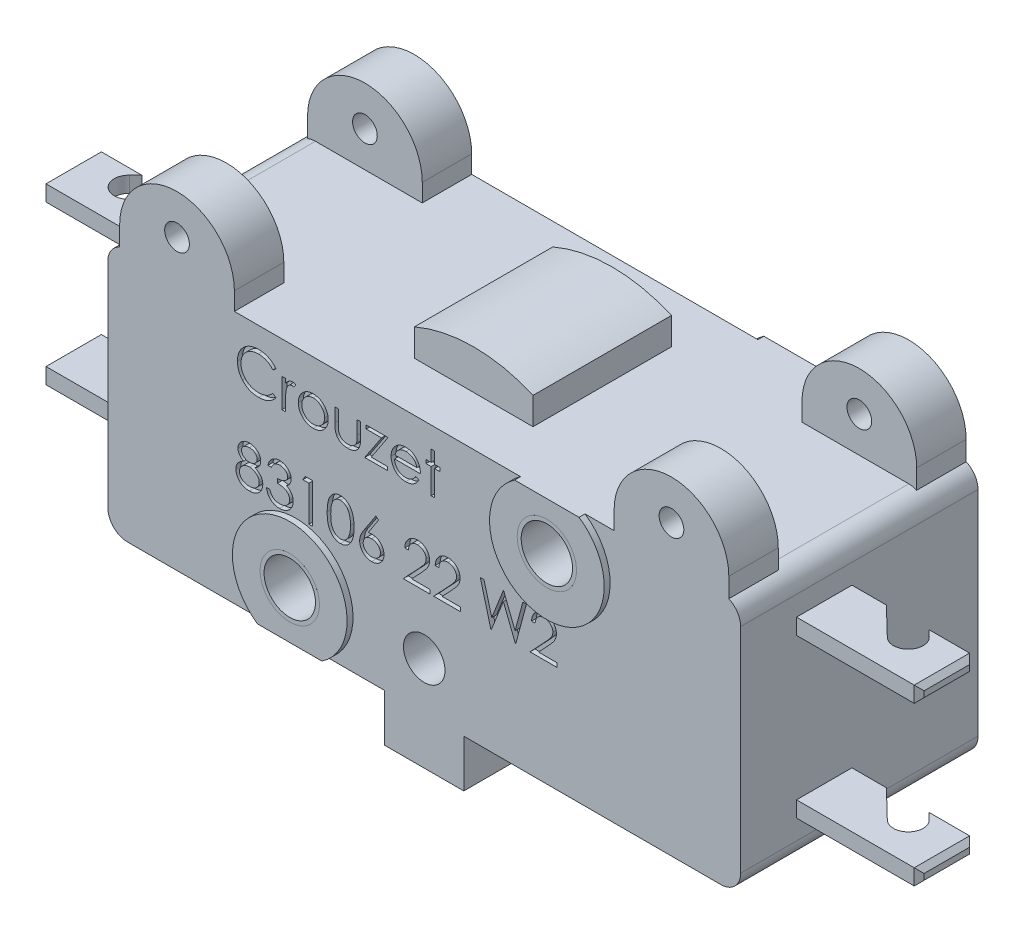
SolidWorks part; units mm, degrees
ref_plane "Plan de face" through (0, 0, 0) normal (0, 0, 1) x (1, 0, 0)
ref_plane "Plan de dessus" through (0, 0, 0) normal (0, 1, 0) x (1, 0, 0)
ref_plane "Plan de droite" through (0, 0, 0) normal (1, 0, 0) x (0, 0, -1)
sketch "Esquisse1" plane through (0, 0, 0) normal (0, 0, 1) x (1, 0, 0)
  line L0 (0, 0) -> (0, 25.0834) construction
  line L1 (-2, 0) -> (-16, 0)
  line L2 (-15.4, 13.7) -> (-15.4, 12.8)
  line L3 (-9.6, 12.8) -> (-9.6, 13.7)
  line L4 (16, 12.8) -> (16, 0)
  line L5 (-15.4, 12.8) -> (-16, 12.8)
  line L7 (-16, 12.8) -> (-16, 0)
  line L8 (12.5, 16.6) -> (18.6013, 16.6) construction
  line L9 (16, 12.8) -> (15.4, 12.8)
  line L10 (-9.6, 12.8) -> (9.6, 12.8)
  line L12 (9.6, 12.8) -> (9.6, 13.7)
  line L13 (15.4, 13.7) -> (15.4, 12.8)
  line L14 (-2, 0) -> (-2, -2.4)
  line L15 (-2, -2.4) -> (2, -2.4)
  line L16 (2, 0) -> (2, -2.4)
  line L17 (2, 0) -> (16, 0)
  line L18 (12.5, 14.6) -> (12.5, 13.7) construction
  arc A0 (15.4, 13.7) -> (9.6, 13.7) centre (12.5, 13.7) ccw
  arc A1 (-15.4, 13.7) -> (-9.6, 13.7) centre (-12.5, 13.7) cw
  circle A2 centre (12.5, 14.6) radius 0.625
  circle A3 centre (-12.5, 14.6) radius 0.625
  point P25 (0, 12.8)
  dimension "D7" = 25
  dimension "D5" = 1.25
  dimension "D8" = 2.9
  dimension "D1" = 32
  dimension "D2" = 12.8
  dimension "D3" = 4
  dimension "D4" = 16.6
  dimension "D6" = 2.4
  dimension "D9" = 1.8
  dimension "D10" = 12.8
extrude "Boss.-Extru.1" add sketch "Esquisse1" along normal mid plane 12
sketch "Esquisse2" plane through (0, 0, 0) normal (1, 0, 0) x (0, 0, -1)
  line L0 (-6, 12.8) -> (6, 12.8) construction
  line L1 (-3.5, 16.6) -> (3.5, 16.6)
  line L2 (-3.5, 16.6) -> (-3.5, 12.8)
  line L3 (-3.5, 12.8) -> (3.5, 12.8)
  line L4 (3.5, 16.6) -> (3.5, 12.8)
  line L5 (0, 0) -> (0, 16.6) construction
  line L6 (6, 16.6) -> (-6, 16.6) construction
  dimension "D1" = 7
extrude "Enlèv. mat.-Extru.1" cut sketch "Esquisse2" against normal mid plane 100
fillet "Congé1" radius 1 4 edges at (16, 12.8, 0) (-16, 12.8, 0) (-16, 0, 0) (16, 0, 0)
sketch "Esquisse3" plane through (0, 0, 6) normal (0, 0, 1) x (1, 0, 0)
  line L0 (0, 0) -> (0, 17.1631) construction
  line L1 (-15, 0) -> (-2, 0) construction
  circle A0 centre (-6.5, 2.4) radius 1.5
  circle A1 centre (6.5, 10.4) radius 1.5
  dimension "D5" = 3
  dimension "D1" = 13
  dimension "D2" = 8
  dimension "D3" = 13
  dimension "D4" = 2.4
extrude "Enlèv. mat.-Extru.2" cut sketch "Esquisse3" against normal through all
sketch "Esquisse4" plane through (0, 0, 6) normal (0, 0, 1) x (1, 0, 0)
  line L0 (0, 0) -> (0, 2.4) construction
  line L1 (-6.5, 2.4) -> (0, 2.4) construction
  circle A0 centre (0, 2.4) radius 1.05
  dimension "D1" = 2.1
extrude "Enlèv. mat.-Extru.3" cut sketch "Esquisse4" against normal blind 3
sketch "Esquisse6" plane through (0, 0, -6) normal (0, 0, -1) x (-1, 0, 0)
  line L2 (-9.6, 12.8) -> (9.6, 12.8) construction
  line L3 (15, 0) -> (2, 0) construction
  line L4 (-8.1279, 12.8) -> (-4.8721, 12.8)
  line L5 (8.1279, 0) -> (4.8721, 0)
  arc A0 (-8.1279, 12.8) -> (-4.8721, 12.8) centre (-6.5, 10.4) ccw
  arc A1 (8.1279, 0) -> (4.8721, 0) centre (6.5, 2.4) ccw
  circle A2 centre (-6.5, 10.4) radius 1.5 construction
  circle A3 centre (6.5, 2.4) radius 1.5 construction
  circle A4 centre (-6.5, 10.4) radius 1.5
  circle A5 centre (6.5, 2.4) radius 1.5
  dimension "D1" = 5.8
extrude "Boss.-Extru.3" add sketch "Esquisse6" along normal blind 0.3
sketch "Esquisse7" plane through (0, 0, 0) normal (0, 0, 1) x (1, 0, 0)
  line L0 (0, 0) -> (0, 14.8) construction
  line L1 (9.6, 12.8) -> (-9.6, 12.8) construction
  line L2 (-3, 12.8) -> (3, 12.8)
  line L3 (-3, 12.8) -> (-3, 14.1739)
  line L4 (-3, 14.1739) -> (3, 14.1739) construction
  line L5 (3, 12.8) -> (3, 14.1739)
  arc A0 (3, 14.1739) -> (-3, 14.1739) centre (0, 7.3) ccw
  circle A1 centre (-6.5, 2.4) radius 1.5 construction
  dimension "D3" = 7.5
  dimension "D1" = 6
  dimension "D2" = 12.4
extrude "Boss.-Extru.4" add sketch "Esquisse7" along normal mid plane 7
sketch "Esquisse5" plane through (0, 0, -6) normal (0, 0, -1) x (-1, 0, 0)
  circle A0 centre (0, 2.4) radius 1
  circle A1 centre (0, 2.4) radius 1.05 construction
  dimension "D1" = 2
extrude "Boss.-Extru.2" add sketch "Esquisse5" along normal offset from surface (1.3 mm away) 1
mirror "Symétrie2" about plane through (0, 0, 0) normal (0, 0, 1) of "Boss.-Extru.3"
sketch "Esquisse8" plane through (16, 0, 0) normal (1, 0, 0) x (0, 0, -1)
  line L0 (0, 0) -> (0, 10.8) construction
  line L1 (-3.175, 10.8) -> (3.175, 10.8)
  line L2 (-3.175, 10.8) -> (-3.175, 10)
  line L3 (-3.175, 10) -> (3.175, 10)
  line L4 (3.175, 10.8) -> (3.175, 10)
  line L5 (-3.175, 2.8) -> (3.175, 2.8)
  line L6 (-3.175, 2.8) -> (-3.175, 2)
  line L7 (-3.175, 2) -> (3.175, 2)
  line L8 (3.175, 2.8) -> (3.175, 2)
  line L9 (-3.175, 10.4) -> (3.175, 10.4) construction
  line L10 (-3.175, 2.4) -> (3.175, 2.4) construction
  line L12 (6.3, 10.4) -> (-6.3, 10.4) construction
  line L13 (-3, 2.4) -> (-6, 2.4) construction
  dimension "D1" = 6.35
  dimension "D2" = 0.8
extrude "Boss.-Extru.5" add sketch "Esquisse8" along normal blind 11.5
sketch "Esquisse11" plane through (0, 10.8, 0) normal (0, 1, 0) x (1, 0, 0)
  line L0 (16, -0.375) -> (17.7425, -0.375)
  line L1 (16, 3.175) -> (16, -3.175) construction
  line L2 (22.2, -0.375) -> (22.2, -3.175)
  line L3 (27.5, -3.175) -> (16, -3.175) construction
  line L4 (22.2, -3.175) -> (27.5, -3.175)
  line L5 (27.5, -3.175) -> (27.5, 3.175)
  line L6 (27.5, 3.175) -> (16, 3.175)
  line L7 (16, 3.175) -> (16, -0.375)
  line L8 (19.9, -0.375) -> (20.2214, -0.6859)
  line L9 (17.7425, -0.375) -> (19.1786, -1.7641)
  line L10 (19.7, -1.975) -> (22.2, -1.975) construction
  line L11 (19.9, -0.375) -> (22.2, -0.375)
  arc A0 (19.1786, -1.7641) -> (20.2214, -0.6859) centre (19.7, -1.225) ccw
  dimension "D3" = 1.5
  dimension "D1" = 2.8
  dimension "D2" = 6.2
  dimension "D4" = 1.6
  dimension "D5" = 2.3
  dimension "D6" = 2.5
extrude "Enlèv. mat.-Extru.6" cut sketch "Esquisse11" against normal through all
chamfer "Chanfrein2" distance 0.25 angle 45 8 edges at (22.2, 2, 1.775) (22.2, 2.4, 3.175) (22.2, 2.8, 1.775) (22.2, 2.4, 0.375) (22.2, 10.8, 1.775) (22.2, 10.4, 0.375) (22.2, 10, 1.775) (22.2, 10.4, 3.175)
mirror "Symétrie3" about plane through (0, 0, 0) normal (1, 0, 0) of "Chanfrein2", "Enlèv. mat.-Extru.6", "Boss.-Extru.5"
sketch "Esquisse12" plane through (0, 0, 6) normal (0, 0, 1) x (1, 0, 0)
  line L0 (-9.6, 9.7) -> (9.6, 9.7) construction
  line L1 (0, 0) -> (0, 9.7) construction
  line L2 (2, 0) -> (15, 0) construction
  line L3 (-9.6, 12.8) -> (-9.6, 13.7) construction
  text T0 "Crouzet  83106 22 W2" font "Century Gothic" height 2
  dimension "D1" = 9.7
extrude "Enlèv. mat.-Extru.7" cut sketch "Esquisse12" against normal blind 0.25
sketch "Esquisse9" [suppressed] plane through (0, 10.8, 0) normal (0, 1, 0) x (1, 0, 0)
  line L0 (16, 3.175) -> (16, -3.175) construction
  line L1 (16, -0.375) -> (19.3, -0.375)
  line L2 (16, -0.375) -> (16, 3.175)
  line L3 (16, 3.175) -> (19.3, 3.175)
  line L4 (19.3, -0.375) -> (19.3, 3.175)
  line L5 (27.5, 3.175) -> (16, 3.175) construction
  line L6 (27.5, 3.175) -> (27.5, -3.175) construction
  line L7 (27.5, -3.175) -> (16, -3.175) construction
  line L8 (22.25, 0) -> (0, 0) construction
  circle A0 centre (22.25, 0) radius 1.6
  dimension "D3" = 3.2
  dimension "D1" = 8.2
  dimension "D2" = 2.8
  dimension "D4" = 5.25
chamfer "Chanfrein1" [suppressed] distance 0.25 angle 45
sketch "Esquisse10" plane through (0, 0, 6) normal (0, 0, 1) x (1, 0, 0)
  line L0 (-9.9858, 9.7) -> (9.9858, 9.7) construction
  line L1 (0, 0) -> (0, 9.7) construction
  line L2 (2, 0) -> (15, 0) construction
  text T0 "Crouzet  83106 022 W3" font "Century Gothic" height 2
  dimension "D1" = 9.7
extrude "Enlèv. mat.-Extru.5" [suppressed] cut sketch "Esquisse10" against normal blind 0.5
extrude "Enlèv. mat.-Extru.8" [suppressed] cut sketch "Esquisse9" against normal through all
mirror "Symétrie1" [suppressed] about plane through (0, 0, 0) normal (1, 0, 0)
sketch "Esquisse13" plane through (0, 10.8, 0) normal (0, 1, 0) x (1, 0, 0)
  line L0 (16, -0.375) -> (16.8, -0.375)
  line L1 (16, -0.375) -> (16, -3.175) construction
  line L2 (16.8, -0.375) -> (16.8, 3.175)
  line L4 (16.8, 3.175) -> (22.2, 3.175)
  line L5 (22.2, 3.175) -> (22.2, -3.175)
  line L6 (21.95, -3.175) -> (16, -3.175) construction
  line L7 (22.2, -3.175) -> (28, -3.175)
  line L8 (28, -3.175) -> (28, 5.175)
  line L10 (28, 5.175) -> (16, 5.175)
  line L11 (16, 5.175) -> (16, -0.375)
  line L12 (16.8, 3.175) -> (22.2, -3.175) construction
  line L13 (22.2, 3.175) -> (16.8, -3.175) construction
  circle A0 centre (19.5, 0) radius 1.25
  dimension "D5" = 2.5
  dimension "D1" = 2
  dimension "D2" = 6.2
  dimension "D3" = 0.8
  dimension "D4" = 2.8
  dimension "D6" = 6.35
  dimension "D7" = 12
extrude "Enlèv. mat.-Extru.9" [suppressed] cut sketch "Esquisse13" against normal through all
mirror "Symétrie6" [suppressed] about plane through (0, 0, 0) normal (1, 0, 0)
sketch "Esquisse14" [suppressed] plane through (22.2, 0, 0) normal (1, 0, 0) x (0, 0, -1)
  line L0 (-3.25, 8.6) -> (-3.25, 11.6)
  line L1 (-3.25, 11.6) -> (3.25, 11.6)
  line L2 (3.25, 11.6) -> (3.25, 8.6)
  line L3 (3.25, 8.6) -> (4.05, 8.6)
  line L4 (4.05, 8.6) -> (4.05, 11.6)
  line L5 (3.25, 12.4) -> (-3.25, 12.4)
  line L6 (-4.05, 11.6) -> (-4.05, 8.6)
  line L7 (-4.05, 8.6) -> (-3.25, 8.6)
  line L8 (3.175, 10.8) -> (-3.175, 10.8) construction
  line L9 (0, 0) -> (0, 12.4) construction
  line L11 (3.25, 4.4) -> (-3.25, 4.4)
  line L12 (-4.05, 3.6) -> (-4.05, 0.6)
  line L13 (-4.05, 0.6) -> (-3.25, 0.6)
  line L14 (-3.25, 0.6) -> (-3.25, 3.6)
  line L15 (-3.25, 3.6) -> (3.25, 3.6)
  line L16 (3.25, 3.6) -> (3.25, 0.6)
  line L17 (3.25, 0.6) -> (4.05, 0.6)
  line L18 (4.05, 0.6) -> (4.05, 3.6)
  arc A0 (4.05, 11.6) -> (3.25, 12.4) centre (3.25, 11.6) ccw
  arc A1 (-3.25, 12.4) -> (-4.05, 11.6) centre (-3.25, 11.6) ccw
  arc A2 (-3.25, 4.4) -> (-4.05, 3.6) centre (-3.25, 3.6) ccw
  arc A3 (4.05, 3.6) -> (3.25, 4.4) centre (3.25, 3.6) ccw
  dimension "D1" = 0.8
  dimension "D2" = 0.8
  dimension "D3" = 0.8
  dimension "D4" = 0.8
  dimension "D5" = 0.8
  dimension "D6" = 8.1
  dimension "D7" = 3
  dimension "D8" = 2
extrude "Boss.-Extru.6" [suppressed] add sketch "Esquisse14" against normal up to vertex separate body
sketch "Esquisse15" [suppressed] plane through (0, 12.4, 0) normal (0, 1, 0) x (1, 0, 0)
  line L0 (16.8, -3.25) -> (22.2, 3.25) construction
  circle A0 centre (19.5, 0) radius 1.5
  dimension "D1" = 3
extrude "Enlèv. mat.-Extru.10" [suppressed] cut sketch "Esquisse15" against normal up to next
sketch "Esquisse16" [suppressed] plane through (0, 4.4, 0) normal (0, 1, 0) x (1, 0, 0)
  circle A0 centre (19.5, 0) radius 1.5 construction
  circle A1 centre (19.5, 0) radius 1.5
extrude "Enlèv. mat.-Extru.11" [suppressed] cut sketch "Esquisse16" against normal up to next
sketch "Esquisse17" [suppressed] plane through (0, 0, 0) normal (0, 0, 1) x (1, 0, 0)
  line L0 (19.5, 8.9) -> (19.5, 13.7744)
  line L1 (16.8, 12.4) -> (22.2, 12.4) construction
  line L2 (21.7, 12.4) -> (21.7, 13.2)
  line L3 (19.5, 11.6) -> (19.5, 12.4) construction
  line L4 (19.5, 12.4) -> (19.5, 8.9) construction
  line L5 (19.5, 12.4) -> (19.5, 13.7744) construction
  line L6 (20.75, 12.4) -> (20.75, 9.15)
  line L7 (20.5, 8.9) -> (19.5, 8.9)
  line L8 (20.75, 9.15) -> (20.5, 8.9)
  line L9 (20.75, 12.4) -> (21.7, 12.4)
  arc A0 (21.7, 13.2) -> (19.5, 13.7744) centre (19.5, 9.2744) ccw
  point P12 (20.75, 8.9)
  dimension "D5" = 4.5
  dimension "D3" = 0.25
  dimension "D1" = 2.5
  dimension "D2" = 2.2
  dimension "D4" = 3.5
  dimension "D6" = 0.8
revolve "Révolution1" [suppressed] add sketch "Esquisse17" angle 360 about L0
sketch "Esquisse18" [suppressed] plane through (0, 0, 0) normal (0, 0, 1) x (1, 0, 0)
  line L0 (19.5, 14.737) -> (19.5, 10.9876) construction
  line L1 (18.875, 15) -> (20.125, 15)
  line L2 (18.875, 15) -> (18.875, 13)
  line L3 (18.875, 13) -> (20.125, 13)
  line L4 (20.125, 15) -> (20.125, 13)
  line L5 (19.5, 8.6) -> (19.5, 15.9514) construction
  line L6 (16.8, 8.6) -> (22.2, 8.6) construction
  line L7 (19.5, 10) -> (19.5, 10.8) construction
  line L8 (16.8, 12.4) -> (22.2, 12.4) construction
  dimension "D1" = 1.25
  dimension "D2" = 0.6
  dimension "D3" = 2
extrude "Enlèv. mat.-Extru.12" [suppressed] cut sketch "Esquisse18" against normal mid plane 10
pattern_linear "Répétition linéaire2" [suppressed] count 2 spacing 8
mirror "Symétrie7" [suppressed] about plane through (0, 0, 0) normal (1, 0, 0)
sketch "Esquisse19" [suppressed] plane through (0, 0, 6) normal (0, 0, 1) x (1, 0, 0)
  line L0 (-9.6, 9.7) -> (9.6, 9.7) construction
  line L1 (0, 0) -> (0, 9.7) construction
  line L2 (-9.6, 12.8) -> (-9.6, 9.7) construction
  line L3 (2, 0) -> (15, 0) construction
  text T0 "Crouzet  83106 22 W1" font "Century Gothic" height 2
  dimension "D1" = 9.7
extrude "Enlèv. mat.-Extru.13" [suppressed] cut sketch "Esquisse19" against normal blind 0.5
sketch "Esquisse20" [suppressed] plane through (0, 0, 3.5) normal (0, 0, 1) x (1, 0, 0)
fillet "Congé2" radius 0.25 1 edges at (-1, 2.4, -7.3)
sketch "Esquisse21" plane through (0, 0, 0) normal (0, 0, 1) x (1, 0, 0)
  circle A0 centre (6.5, 10.4) radius 1.5 construction
  circle A1 centre (-6.5, 2.4) radius 1.5 construction
  circle A2 centre (6.5, 10.4) radius 1.5
  circle A3 centre (-6.5, 2.4) radius 1.5
  circle A4 centre (6.5, 10.4) radius 1.3
  circle A5 centre (-6.5, 2.4) radius 1.3
  dimension "D1" = 2.6
extrude "Boss.-Extru.7" add sketch "Esquisse21" along normal up to surface and the other way up to surface separate body
